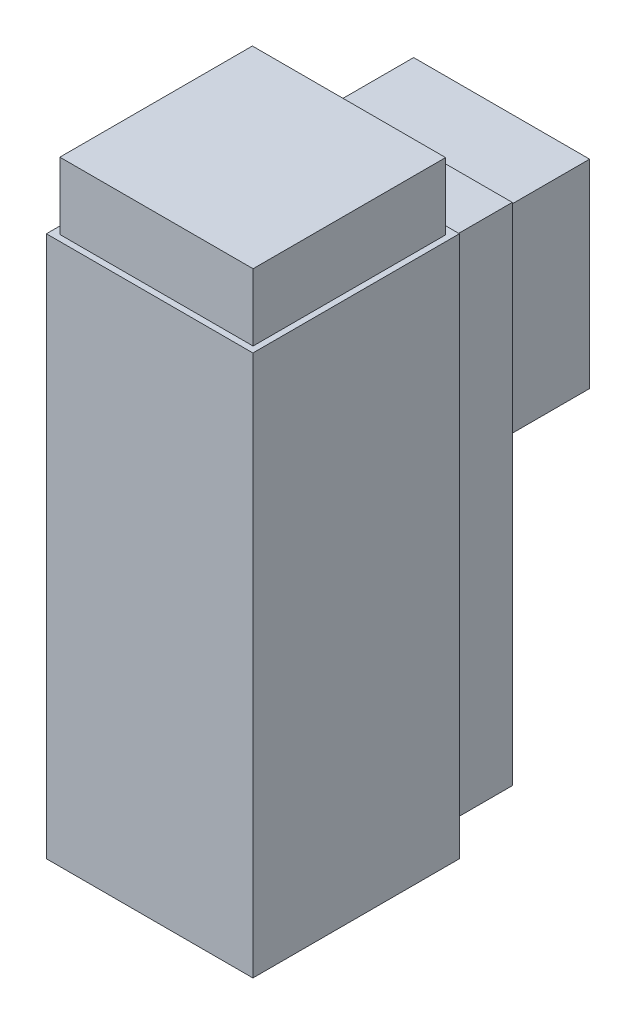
SolidWorks part; units mm, degrees
ref_plane "Front Plane" through (0, 0, 0) normal (0, 0, 1) x (1, 0, 0)
ref_plane "Top Plane" through (0, 0, 0) normal (0, 1, 0) x (1, 0, 0)
ref_plane "Right Plane" through (0, 0, 0) normal (1, 0, 0) x (0, 0, -1)
sketch "Sketch1" plane through (0, 0, 0) normal (0, 0, 1) x (1, 0, 0)
  line L1 (-16.5, 43.25) -> (16.5, 43.25)
  line L2 (-16.5, 43.25) -> (-16.5, -43.25)
  line L3 (-16.5, -43.25) -> (16.5, -43.25)
  line L4 (16.5, 43.25) -> (16.5, -43.25)
  line L5 (-16.5, 43.25) -> (16.5, -43.25) construction
  line L6 (-16.5, -43.25) -> (16.5, 43.25) construction
  point P0 (0, 0)
  dimension "D1" = 86.5
  dimension "D2" = 33
extrude "Boss-Extrude1" add sketch "Sketch1" along normal blind 33
sketch "Sketch2" plane through (0, -43.25, 0) normal (0, -1, 0) x (-1, 0, 0)
  line L0 (0, 0) -> (0, -33) construction
  line L1 (16.5, -33) -> (-16.5, -33) construction
  circle A0 centre (0, -16.5) radius 7.5
  dimension "D1" = 15
extrude "Boss-Extrude2" add sketch "Sketch2" along normal blind 8
sketch "Sketch3" plane through (0, -51.25, 0) normal (0, -1, 0) x (1, 0, 0)
  circle A0 centre (0, 16.6002) radius 2.5
  dimension "D1" = 5
extrude "Cut-Extrude1" cut sketch "Sketch3" against normal blind 8
sketch "Sketch4" plane through (0, 0, 0) normal (0, 0, -1) x (-1, 0, 0)
  line L1 (-14.9511, 41.8144) -> (15.273, 41.8144)
  line L2 (-14.9511, 41.8144) -> (-14.9511, -38.9107)
  line L3 (-14.9511, -38.9107) -> (15.273, -38.9107)
  line L4 (15.273, 41.8144) -> (15.273, -38.9107)
extrude "Boss-Extrude5" add sketch "Sketch4" along normal blind 10
sketch "Sketch6" plane through (0, 0, -10) normal (0, 0, -1) x (-1, 0, 0)
  line L1 (-13.8033, 40.4753) -> (14.3166, 40.4753)
  line L2 (-13.8033, 40.4753) -> (-13.8033, 8.7209)
  line L3 (-13.8033, 8.7209) -> (14.3166, 8.7209)
  line L4 (14.3166, 40.4753) -> (14.3166, 8.7209)
extrude "Boss-Extrude6" add sketch "Sketch6" along normal blind 13.5
sketch "Sketch7" plane through (0, 43.25, 0) normal (0, 1, 0) x (1, 0, 0)
  line L1 (-15.3256, -1.2617) -> (15.5543, -1.2617)
  line L2 (-15.3256, -1.2617) -> (-15.3256, -32.0273)
  line L3 (-15.3256, -32.0273) -> (15.5543, -32.0273)
  line L4 (15.5543, -1.2617) -> (15.5543, -32.0273)
extrude "Boss-Extrude7" add sketch "Sketch7" along normal blind 10.7
